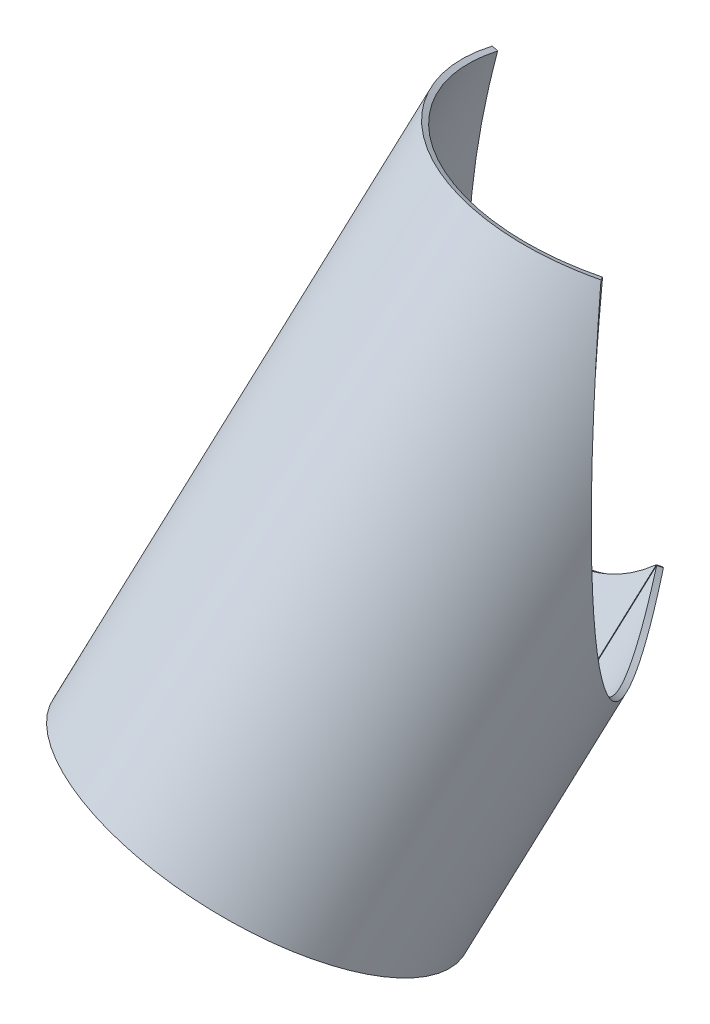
SolidWorks part; units mm, degrees
ref_plane "前视基准面" through (0, 0, 0) normal (0, 0, 1) x (1, 0, 0)
ref_plane "上视基准面" through (0, 0, 0) normal (0, 1, 0) x (1, 0, 0)
ref_plane "右视基准面" through (0, 0, 0) normal (1, 0, 0) x (0, 0, -1)
imported_body "基体零件-等径Y形四通管-1"
sheet metal parameters "钣金1" parameters "D1"=0.7366, "厚度"=6
bend "圆角折弯1" bend radius 174 bend angle 359.682 parameters "D5"=1
flatten bends "展开-折弯1"
sketch "尖角-草图1" plane through (-38.6104, -495.2491, 67.8753) normal (0.4354, -0.5, -0.7486) x (-0.9002, -0.2418, -0.3621)
  line L0 (-481.461, -301.147) -> (-567.8815, -2.1946) construction
  dimension "D1" = 0
process bends "加工-折弯1" parameters "D1"=0
sketch "平面-草图1" plane through (-38.6104, -495.2491, 67.8753) normal (0.4354, -0.5, -0.7486) x (-0.9002, -0.2418, -0.3621)
